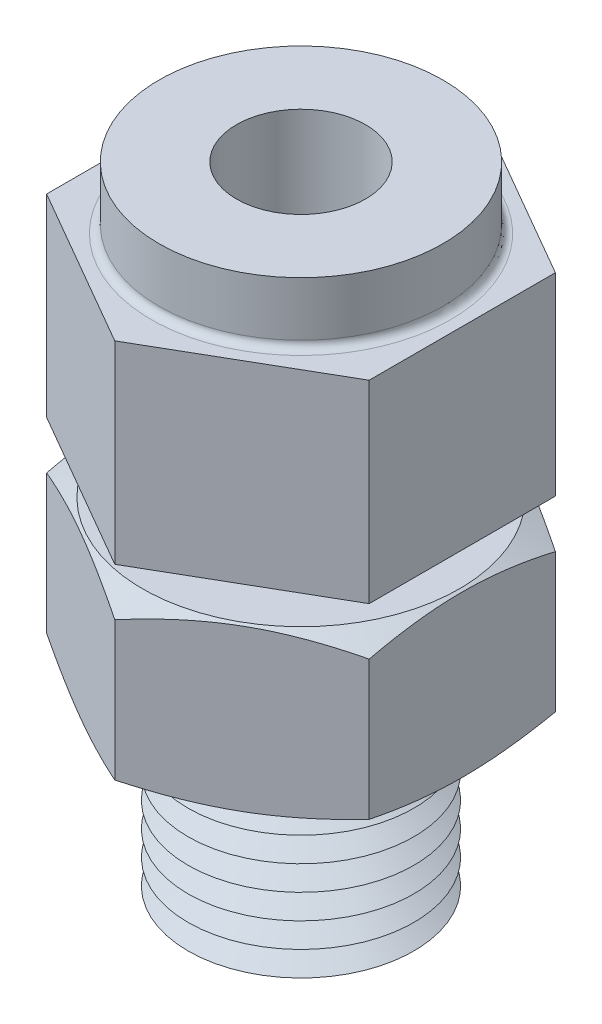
SolidWorks part; units mm, degrees
ref_plane "Plane1" through (0, 0, 0) normal (0, 0, 1) x (1, 0, 0)
ref_plane "Plane2" through (0, 0, 0) normal (0, 1, 0) x (1, 0, 0)
ref_plane "Plane3" through (0, 0, 0) normal (1, 0, 0) x (0, 0, -1)
sketch "Sketch1" plane through (0, 0, 0) normal (0, 0, 1) x (1, 0, 0)
  line L0 (0, 0) -> (7.8011, 0)
  line L1 (9.1654, 0.5581) -> (9.1654, 7.3902)
  line L2 (9.1654, 7.3902) -> (7.8011, 8.0264)
  line L3 (7.8011, 8.0264) -> (0, 8.0264)
  line L4 (0, 8.0264) -> (0, 0)
  line L5 (0, 0) -> (0, 100.076) construction
  line L6 (7.8011, 0) -> (9.1654, 0.5581)
revolve "Base-Revolve" add sketch "Sketch1" angle 360 about L5
sketch "Sketch2" plane through (0, 0, 0) normal (0, 0, 1) x (1, 0, 0)
  line L0 (0, 0) -> (0, 100.076) construction
  line L1 (0, -9.144) -> (4.5021, -9.144)
  line L2 (4.5021, -9.144) -> (5.5562, -8.5354)
  line L3 (5.5562, -8.5354) -> (4.5021, -7.9268)
  line L4 (4.5021, -7.9268) -> (5.5562, -7.3182)
  line L5 (5.5562, -7.3182) -> (4.5021, -6.7096)
  line L6 (4.5021, -6.7096) -> (5.5562, -6.101)
  line L7 (5.5562, -6.101) -> (4.5021, -5.4924)
  line L8 (4.5021, -5.4924) -> (5.5562, -4.8838)
  line L9 (5.5562, -4.8838) -> (4.5021, -4.2752)
  line L10 (4.5021, -4.2752) -> (5.5562, -3.6666)
  line L11 (5.5562, -3.6666) -> (4.5021, -3.058)
  line L12 (4.5021, -3.058) -> (5.5562, -2.4494)
  line L13 (5.5562, -2.4494) -> (4.5021, -1.8408)
  line L14 (4.5021, -1.8408) -> (5.5565, -1.2144)
  line L15 (5.5565, -1.2144) -> (4.4685, -0.5863)
  line L16 (4.4685, -0.5863) -> (5.5562, -0.015)
  line L17 (5.5562, -0.015) -> (5.5562, 0)
  line L18 (5.5562, 0) -> (0, 0)
  line L19 (0, 0) -> (0, -9.144)
  dimension "D1" = 9.144
revolve "Boss-Revolve1" add sketch "Sketch2" angle 360 about L0
ref_plane "Plane4" through (0, 8.0264, 0) normal (0, 1, 0) x (-1, 0, 0)
sketch "Sketch3" plane through (0, 8.0264, 0) normal (0, 1, 0) x (-1, 0, 0)
  line L0 (7.9375, 4.5827) -> (0, 9.1654)
  line L1 (0, 9.1654) -> (-7.9375, 4.5827)
  line L2 (-7.9375, 4.5827) -> (-7.9375, -4.5827)
  line L3 (-7.9375, -4.5827) -> (0, -9.1654)
  line L4 (0, -9.1654) -> (7.9375, -4.5827)
  line L5 (7.9375, -4.5827) -> (7.9375, 4.5827)
  line L6 (10.082, 10.082) -> (-10.082, 10.082)
  line L7 (-10.082, 10.082) -> (-10.082, -10.082)
  line L8 (-10.082, -10.082) -> (10.082, -10.082)
  line L9 (10.082, -10.082) -> (10.082, 10.082)
extrude "Cut-Extrude1" cut sketch "Sketch3" against normal blind 8.0264
sketch "Sketch4" plane through (0, 8.0264, 0) normal (0, 1, 0) x (-1, 0, 0)
  circle A0 centre (0, 0) radius 5.5562
  dimension "D1" = 11.1125
extrude "Boss-Extrude1" add sketch "Sketch4" along normal blind 1.7272
sketch "Sketch8" plane through (0, 9.7536, 0) normal (0, 1, 0) x (-1, 0, 0)
  line L0 (-7.9375, -4.5827) -> (-7.9375, 4.5827)
  line L1 (-7.9375, 4.5827) -> (0, 9.1654)
  line L2 (0, 9.1654) -> (7.9375, 4.5827)
  line L3 (7.9375, 4.5827) -> (7.9375, -4.5827)
  line L4 (7.9375, -4.5827) -> (0, -9.1654)
  line L5 (0, -9.1654) -> (-7.9375, -4.5827)
extrude "Boss-Extrude3" add sketch "Sketch8" along normal blind 9.525
sketch "Sketch9" plane through (0, 19.2786, 0) normal (0, 1, 0) x (-1, 0, 0)
  circle A0 centre (0, 0) radius 6.985
  dimension "D1" = 13.97
extrude "Boss-Extrude4" add sketch "Sketch9" along normal blind 3.048
sketch "Sketch10" plane through (0, 22.3266, 0) normal (0, 1, 0) x (-1, 0, 0)
  circle A0 centre (0, 0) radius 3.175
  dimension "D1" = 6.35
extrude "Cut-Extrude2" cut sketch "Sketch10" against normal through all
fillet "Fillet1" radius 0.381
